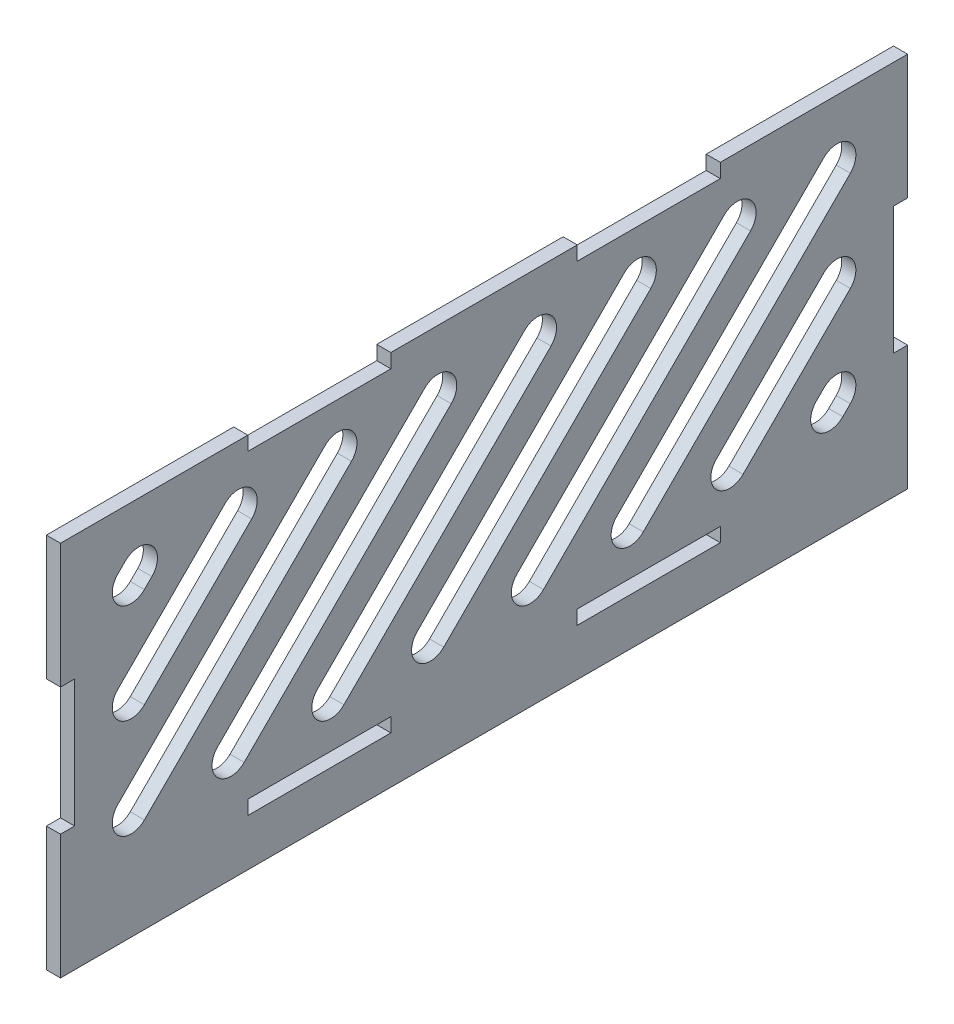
SolidWorks part; units mm, degrees
ref_plane "前视基准面" through (0, 0, 0) normal (0, 0, 1) x (1, 0, 0)
ref_plane "上视基准面" through (0, 0, 0) normal (0, 1, 0) x (1, 0, 0)
ref_plane "右视基准面" through (0, 0, 0) normal (1, 0, 0) x (0, 0, -1)
sketch "Sketch1" plane through (0, 0, 0) normal (1, 0, 0) x (0, 0, -1)
  line L1 (-90, -40) -> (90, -40)
  line L2 (-90, -40) -> (-90, 40)
  line L3 (-90, 40) -> (90, 40)
  line L4 (90, -40) -> (90, 40)
  line L5 (-90, -40) -> (90, 40) construction
  line L6 (-90, 40) -> (90, -40) construction
  point P0 (0, 0)
  dimension "D1" = 80
  dimension "D2" = 180
extrude "Boss-Extrude1" add sketch "Sketch1" along normal blind 3
sketch "Sketch2" plane through (0, 0, 0) normal (-1, 0, 0) x (0, 0, 1)
  line L0 (-90, -40) -> (-90, 40) construction
  line L1 (-90, -27) -> (90, -27)
  line L2 (-90, -27) -> (-90, -30)
  line L3 (-90, -30) -> (90, -30)
  line L4 (90, -27) -> (90, -30)
  line L5 (90, 40) -> (90, -40) construction
  line L6 (90, -40) -> (-90, -40) construction
  line L8 (-50, -27) -> (-20, -27)
  line L9 (-50, -27) -> (-50, -30)
  line L10 (-50, -30) -> (-20, -30)
  line L11 (-20, -27) -> (-20, -30)
  line L12 (20, -27) -> (50, -27)
  line L13 (20, -27) -> (20, -30)
  line L14 (20, -30) -> (50, -30)
  line L15 (50, -27) -> (50, -30)
  line L16 (-50.2, -27) -> (-19.8, -27)
  line L17 (-50.2, -27) -> (-50.2, -30)
  line L18 (-50.2, -30) -> (-19.8, -30)
  line L19 (-19.8, -27) -> (-19.8, -30)
  line L20 (19.8, -27) -> (50.2, -27)
  line L21 (19.8, -27) -> (19.8, -30)
  line L22 (19.8, -30) -> (50.2, -30)
  line L23 (50.2, -27) -> (50.2, -30)
  dimension "D1" = 10
  dimension "D2" = 3
  dimension "D3" = 0.2
  dimension "D4" = 0.2
  dimension "D5" = 0.2
  dimension "D6" = 0.2
extrude "Cut-Extrude1" cut sketch "Sketch2" against normal blind 3 contours L23 L1 L15 L3 | L1 L21 L3 L13 | L19 L1 L11 L3 | L11 L1 L9 L3 | L1 L17 L3 L9
sketch "Sketch3" plane through (0, 0, 0) normal (-1, 0, 0) x (0, 0, 1)
  line L0 (90, -40) -> (-90, -40) construction
  line L1 (90, 40) -> (87, 40)
  line L2 (90, 40) -> (90, 13.3333)
  line L3 (90, 13.3333) -> (87, 13.3333)
  line L4 (87, 40) -> (87, 13.3333)
  line L5 (90, 13.3333) -> (87, 13.3333)
  line L6 (90, 13.3333) -> (90, -13.3333)
  line L7 (90, -13.3333) -> (87, -13.3333)
  line L8 (87, 13.3333) -> (87, -13.3333)
  line L9 (90, -13.3333) -> (87, -13.3333)
  line L10 (90, -13.3333) -> (90, -40)
  line L11 (90, -40) -> (87, -40)
  line L12 (87, -13.3333) -> (87, -40)
  line L14 (87, 13.5333) -> (90, 13.5333)
  line L15 (87, 13.5333) -> (87, -13.5333)
  line L16 (87, -13.5333) -> (90, -13.5333)
  line L17 (90, 13.5333) -> (90, -13.5333)
  dimension "D1" = 3
  dimension "D2" = 0.2
  dimension "D3" = 0.2
extrude "Cut-Extrude2" cut sketch "Sketch3" against normal blind 3 contours L3 L8 L7 M14 | L14 L4 L3 M14 | L12 L16 L10 L7
mirror "Mirror1" about plane through (0, 0, 0) normal (0, 0, 1) of "Cut-Extrude2"
pattern_linear "LPattern1" count 2 spacing 67 along (0, 1, 0) of "Cut-Extrude1"
sketch "Sketch4" plane through (3, 0, 0) normal (1, 0, 0) x (0, 0, -1)
  line L0 (-31, 27) -> (-75, -17) construction
  line L1 (-28.1716, 24.1716) -> (-72.1716, -19.8284)
  line L2 (-33.8284, 29.8284) -> (-77.8284, -14.1716)
  line L3 (-19.8, -27) -> (-50.2, -27) construction
  line L4 (75, 27) -> (31, -17) construction
  line L5 (-90, -13.5333) -> (-90, -40) construction
  line L6 (77.8284, 24.1716) -> (33.8284, -19.8284)
  line L7 (-19.8, 37) -> (-50.2, 37) construction
  line L8 (72.1716, 29.8284) -> (28.1716, -14.1716)
  line L9 (90, 13.5333) -> (90, 40) construction
  arc A0 (-28.1716, 24.1716) -> (-33.8284, 29.8284) centre (-31, 27) ccw
  arc A1 (-77.8284, -14.1716) -> (-72.1716, -19.8284) centre (-75, -17) ccw
  arc A2 (77.8284, 24.1716) -> (72.1716, 29.8284) centre (75, 27) ccw
  arc A3 (28.1716, -14.1716) -> (33.8284, -19.8284) centre (31, -17) ccw
  point P2 (-53, 5)
  point P9 (53, 5)
  point P20 (0, 0)
  point P21 (0, 0)
  point P22 (28.6102, -17)
  dimension "D5" = 4
  dimension "D1" = 45
  dimension "D2" = 10
  dimension "D3" = 10
  dimension "D4" = 15
  dimension "D6" = 15
  dimension "D7" = 106
extrude "Cut-Extrude3" cut sketch "Sketch4" against normal blind 10 contours L2 A1 L1 A0
pattern_linear "LPattern2" count 6 spacing 21.2 along (0, 0, -1) of "Cut-Extrude3"
sketch "Sketch5" plane through (3, 0, 0) normal (1, 0, 0) x (0, 0, -1)
  line L0 (-31, 27) -> (-75, 27) construction
  line L1 (-75, 27) -> (-75, -17) construction
  line L2 (-52.2, 27) -> (-75, 4.2) construction
  line L3 (-49.3716, 24.1716) -> (-72.1716, 1.3716)
  line L4 (-55.0284, 29.8284) -> (-77.8284, 7.0284)
  line L5 (-33.8284, 29.8284) -> (-77.8284, -14.1716) construction
  line L6 (31, -17) -> (75, -17) construction
  line L7 (75, -17) -> (75, 27) construction
  line L8 (52.2, -17) -> (75, 5.8) construction
  line L9 (49.3716, -14.1716) -> (72.1716, 8.6284)
  line L10 (55.0284, -19.8284) -> (77.8284, 2.9716)
  line L11 (77.8284, 24.1716) -> (33.8284, -19.8284) construction
  line L12 (-73.4, 27) -> (-75, 25.4) construction
  line L13 (-70.5716, 24.1716) -> (-72.1716, 22.5716)
  line L14 (-76.2284, 29.8284) -> (-77.8284, 28.2284)
  line L15 (73.4, -17) -> (75, -15.4) construction
  line L16 (70.5716, -14.1716) -> (72.1716, -12.5716)
  line L17 (76.2284, -19.8284) -> (77.8284, -18.2284)
  arc A0 (-77.8284, -14.1716) -> (-72.1716, -19.8284) centre (-75, -17) ccw construction
  arc A1 (-49.3716, 24.1716) -> (-55.0284, 29.8284) centre (-52.2, 27) ccw
  arc A2 (-77.8284, 7.0284) -> (-72.1716, 1.3716) centre (-75, 4.2) ccw
  arc A3 (49.3716, -14.1716) -> (55.0284, -19.8284) centre (52.2, -17) ccw
  arc A4 (77.8284, 2.9716) -> (72.1716, 8.6284) centre (75, 5.8) ccw
  arc A5 (-70.5716, 24.1716) -> (-76.2284, 29.8284) centre (-73.4, 27) ccw
  arc A6 (-77.8284, 28.2284) -> (-72.1716, 22.5716) centre (-75, 25.4) ccw
  arc A7 (70.5716, -14.1716) -> (76.2284, -19.8284) centre (73.4, -17) ccw
  arc A8 (77.8284, -18.2284) -> (72.1716, -12.5716) centre (75, -15.4) ccw
  point P3 (-63.6, 15.6)
  point P23 (63.6, -5.6)
  point P32 (-74.2, 26.2)
  point P39 (74.2, -16.2)
  dimension "D2" = 4
  dimension "D4" = 4
  dimension "D6" = 4
  dimension "D7" = 4
  dimension "D1" = 21.2
  dimension "D3" = 21.2
  dimension "D5" = 21.2
  dimension "D8" = 21.2
extrude "Cut-Extrude4" cut sketch "Sketch5" against normal blind 10
